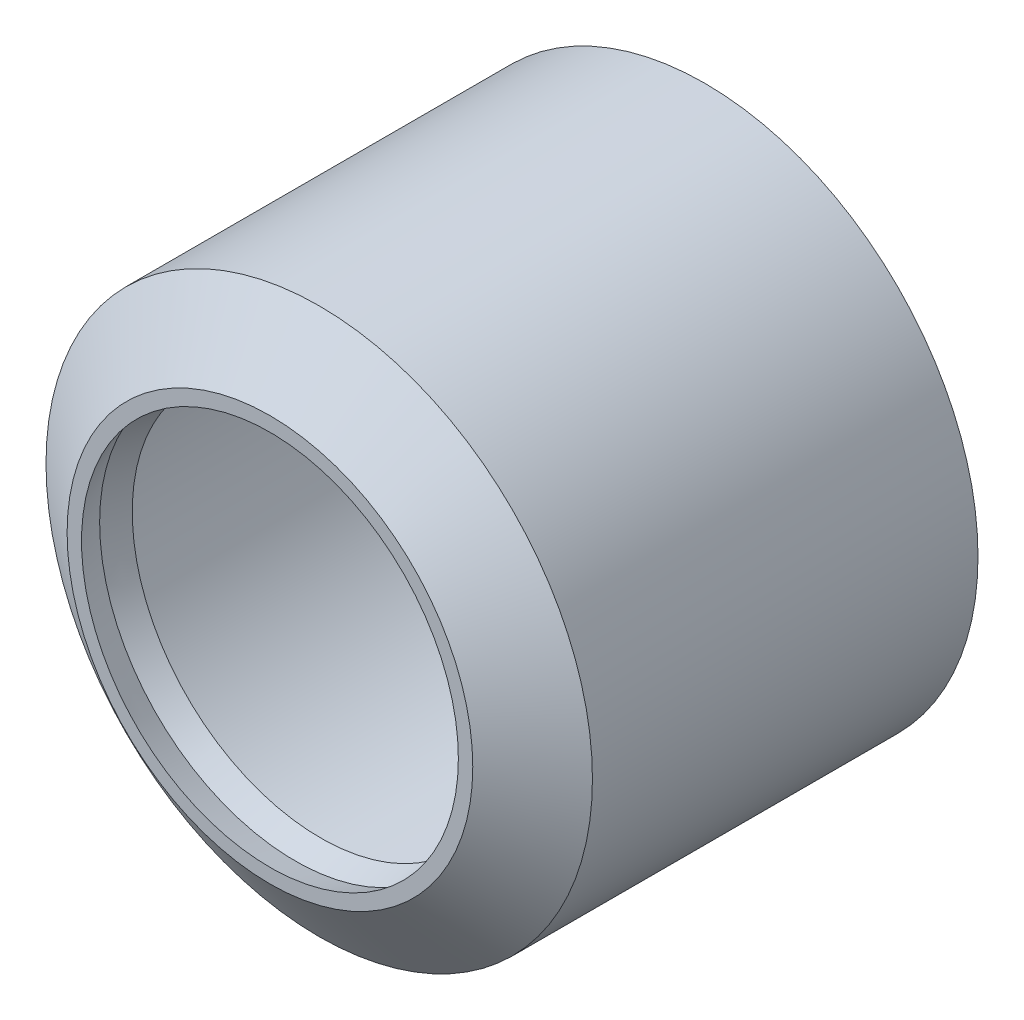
SolidWorks part; units mm, degrees
ref_plane "Plan1" through (0, 0, 0) normal (0, 0, 1) x (1, 0, 0)
ref_plane "Plan2" through (0, 0, 0) normal (0, 1, 0) x (1, 0, 0)
ref_plane "Plan3" through (0, 0, 0) normal (1, 0, 0) x (0, 0, -1)
sketch "Esquisse1" plane through (0, 0, 0) normal (0, 0, 1) x (1, 0, 0)
  circle A0 centre (0, 0) radius 17.6 construction
  circle A1 centre (0, 0) radius 17.6
  circle A2 centre (0, 0) radius 18.85
  dimension "D1" = 1.25
extrude "Base-Extrusion" add sketch "Esquisse1" against normal blind 26.5
sketch "Esquisse2" plane through (0, 0, 0) normal (0, 0, 1) x (1, 0, 0)
  circle A0 centre (0, 0) radius 18.85 construction
  circle A1 centre (0, 0) radius 18.85
  circle A2 centre (0, 0) radius 13 construction
  circle A3 centre (0, 0) radius 13
extrude "Boss.-Extru.1" add sketch "Esquisse2" along normal blind 3.5
chamfer "Chanfrein2" distance 3.4 angle 55
sketch "Esquisse3" plane through (0, 0, 0) normal (1, 0, 0) x (0, 0, -1)
  line L0 (-3.5, 13) -> (-1.75, 13.5)
  line L1 (-3.5, 13.9943) -> (-3.5, -13.9943) construction
  line L2 (-1.75, 13.5) -> (0, 13)
  line L3 (0, -17.6) -> (0, 17.6) construction
  line L4 (0, 13) -> (-3.5, 13) construction
  line L5 (-3.5, 13) -> (0, 13)
  line L6 (-17.6797, 0) -> (20, 0) construction
  line L7 (26.5, 0) -> (-0.1, 0) construction
  dimension "D1" = 0.5
revolve "Enlèvement de matière-Révolution1" cut sketch "Esquisse3" angle 360 about L6
